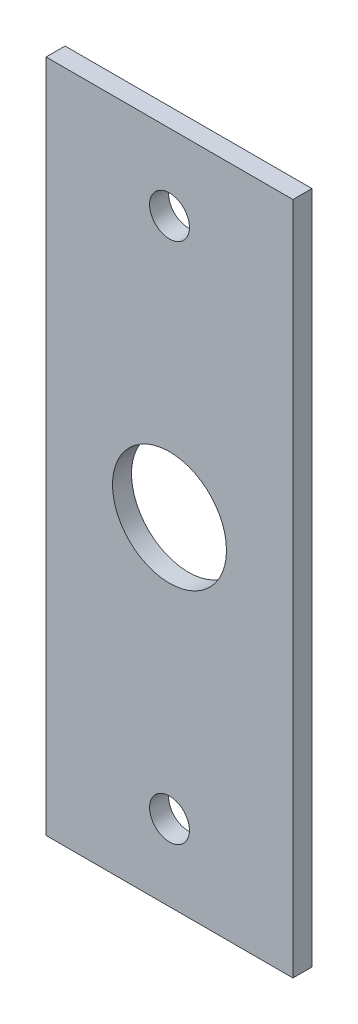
SolidWorks part; units mm, degrees
ref_plane "前视基准面" through (0, 0, 0) normal (0, 0, 1) x (1, 0, 0)
ref_plane "上视基准面" through (0, 0, 0) normal (0, 1, 0) x (1, 0, 0)
ref_plane "右视基准面" through (0, 0, 0) normal (1, 0, 0) x (0, 0, -1)
other "Configuration Table"
sketch "草图1" plane through (0, 0, 0) normal (0, 0, 1) x (1, 0, 0)
  line L1 (-15, 35.5) -> (15, 35.5)
  line L2 (-15, 35.5) -> (-15, -35.5)
  line L3 (-15, -35.5) -> (15, -35.5)
  line L4 (15, 35.5) -> (15, -35.5)
  line L5 (-15, 35.5) -> (15, -35.5) construction
  line L6 (-15, -35.5) -> (15, 35.5) construction
  point P0 (0, 0)
  dimension "D1" = 30
  dimension "D2" = 71
extrude "凸台-拉伸1" add sketch "草图1" along normal blind 2
sketch "草图2" plane through (0, 0, 2) normal (0, 0, 1) x (1, 0, 0)
  circle A0 centre (0, 0) radius 6
  dimension "D1" = 12
extrude "切除-拉伸1" cut sketch "草图2" against normal blind 2
hole_wizard "M5 螺纹孔1" positions "草图3" profile "草图4" tap size "M5" standard "GB"
sketch "草图3" plane through (0, 0, 2) normal (0, 0, 1) x (1, 0, 0)
  point P0 (0, 27.5)
  point P2 (0, -27.5)
  dimension "D1" = 27.5
  dimension "D2" = 27.5
sketch "草图4" plane through (0, 27.5, 2) normal (1, 0, 0) x (0, -1, 0)
  line L0 (0, 0) -> (0, 2)
  line L1 (0, 2) -> (2.1, 2)
  line L2 (2.1, 2) -> (2.1, 0)
  line L5 (2.1, 0) -> (0, 0)
  line L11 (0, -6.35) -> (0, 107.95) construction
  dimension "通孔螺纹孔钻头直径" = 4.2
  dimension "通孔螺纹孔钻头深度" = 2
sketch "草图5" plane through (15, 0, 0) normal (1, 0, 0) x (0, 0, -1)
  line L4 (0, -35.5) -> (0, 35.5)
  line L5 (0, 35.5) -> (-2, 35.5)
  line L6 (-2, 35.5) -> (-2, -35.5)
  line L7 (-2, -35.5) -> (0, -35.5)
  line L8 (0, -35.5) -> (0, 35.5)
  line L9 (0, 35.5) -> (-2, 35.5)
  line L10 (-2, 35.5) -> (-2, -35.5)
  line L11 (-2, -35.5) -> (0, -35.5)
  dimension "D1" = 0
extrude "切除-拉伸2" cut sketch "草图5" against normal blind 2
sketch "草图7" plane through (-15, 0, 0) normal (-1, 0, 0) x (0, 0, 1)
  line L4 (0, 35.5) -> (0, -35.5)
  line L5 (0, -35.5) -> (2, -35.5)
  line L6 (2, -35.5) -> (2, 35.5)
  line L7 (2, 35.5) -> (0, 35.5)
  line L8 (0, 35.5) -> (0, -35.5)
  line L9 (0, -35.5) -> (2, -35.5)
  line L10 (2, -35.5) -> (2, 35.5)
  line L11 (2, 35.5) -> (0, 35.5)
  dimension "D1" = 0
extrude "切除-拉伸3" cut sketch "草图7" against normal blind 2
